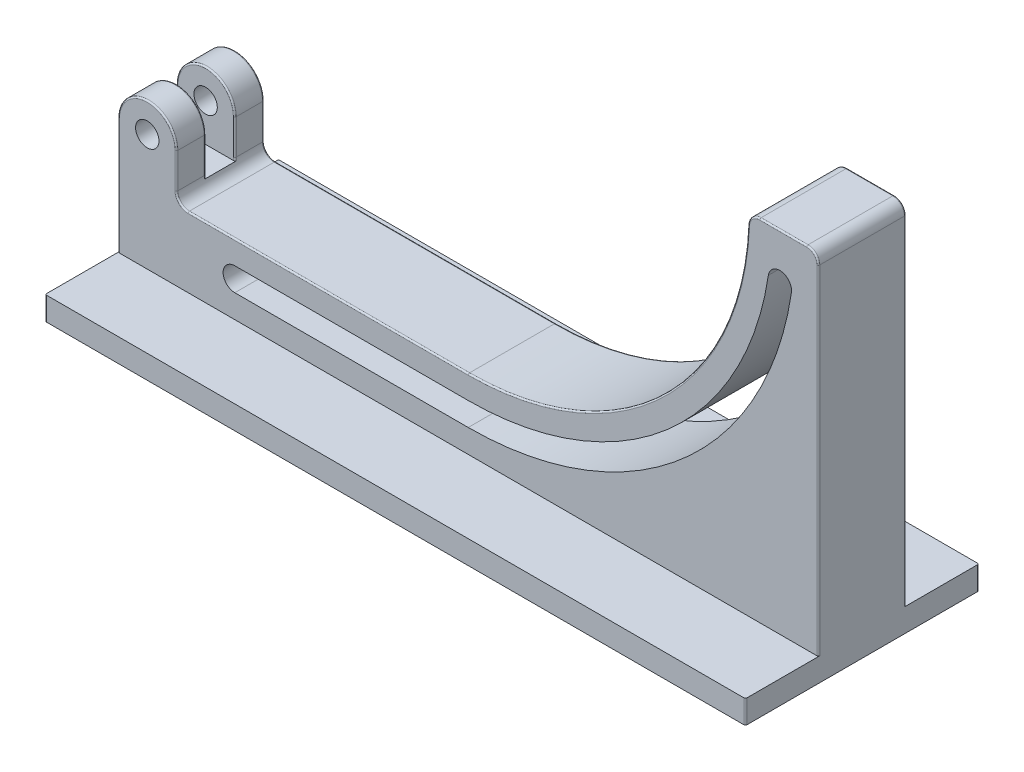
SolidWorks part; units mm, degrees
ref_plane "Front" through (0, 0, 0) normal (0, 0, 1) x (1, 0, 0)
ref_plane "Top" through (0, 0, 0) normal (0, 1, 0) x (1, 0, 0)
ref_plane "Right" through (0, 0, 0) normal (1, 0, 0) x (0, 0, -1)
sketch "Sketch1" plane through (0, 0, 0) normal (0, 1, 0) x (1, 0, 0)
  line L0 (-381, -127) -> (381, 127) construction
  line L1 (-381, 127) -> (381, 127)
  line L2 (-381, 127) -> (-381, -127)
  line L3 (-381, -127) -> (381, -127)
  line L4 (381, 127) -> (381, -127)
  dimension "D1" = 762
  dimension "D2" = 254
extrude "Extrude1" add sketch "Sketch1" against normal blind 25.4
sketch "Sketch2" plane through (0, 0, 0) normal (0, 0, 1) x (1, 0, 0)
  line L0 (-381, 0) -> (381, 0) construction
  line L1 (-381, 0) -> (-317.5, 0)
  line L2 (-381, 0) -> (-381, 127)
  line L4 (-317.5, 0) -> (-317.5, 127)
  arc A0 (-381, 127) -> (-317.5, 127) centre (-349.25, 127) cw
  circle A1 centre (-349.25, 127) radius 12.7
  dimension "D1" = 127
  dimension "D2" = 25.4
  dimension "D3" = 31.75
extrude "Extrude2" add sketch "Sketch2" along normal mid plane 95.25
sketch "Sketch3" plane through (-317.5, 0, 0) normal (1, 0, 0) x (0, 0, -1)
  line L0 (47.625, 158.75) -> (-47.625, 158.75) construction
  line L1 (-15.875, 85.725) -> (15.875, 85.725)
  line L2 (-15.875, 85.725) -> (-15.875, 158.75)
  line L3 (-15.875, 158.75) -> (15.875, 158.75)
  line L4 (15.875, 85.725) -> (15.875, 158.75)
  dimension "D1" = 31.75
  dimension "D2" = 15.875
  dimension "D3" = 73.025
extrude "Cut-Extrude1" cut sketch "Sketch3" against normal through all and the other way through all
sketch "Sketch4" plane through (0, 0, 0) normal (0, 0, 1) x (1, 0, 0)
  line L0 (381, 0) -> (381, 381)
  line L1 (381, 381) -> (304.8, 381)
  line L2 (381, 0) -> (-317.5, 0)
  line L3 (0, 50.8) -> (-254, 50.8)
  line L4 (0, 381) -> (304.8, 381) construction
  line L6 (0, 25.4) -> (-254, 25.4)
  line L8 (0, 76.2) -> (-317.5, 76.2)
  line L10 (-317.5, 76.2) -> (-317.5, 0)
  arc A0 (0, 76.2) -> (304.8, 381) centre (0, 381) ccw
  arc A1 (0, 50.8) -> (326.5563, 332.0815) centre (0, 381) ccw
  arc A2 (0, 25.4) -> (351.676, 328.3185) centre (0, 381) ccw
  arc A3 (326.5563, 332.0815) -> (351.676, 328.3185) centre (339.1162, 330.2) cw
  arc A4 (-254, 50.8) -> (-254, 25.4) centre (-254, 38.1) ccw
  dimension "D1" = 330.2
  dimension "D2" = 355.6
  dimension "D3" = 304.8
  dimension "D4" = 76.2
  dimension "D5" = 76.2
  dimension "D6" = 254
  dimension "D8" = 50.8
extrude "Extrude3" add sketch "Sketch4" along normal mid plane 95.25
fillet "Fillet1" radius 12.7 3 edges at (304.8, 381, 0) (381, 381, 0) (-317.5, 76.2, 0)
fillet "Fillet2" radius 1.5875 32 edges at (-317.5, 107.95, -47.625) (-381, 106.3625, -15.875) (-317.5, 107.95, -15.875) (-317.5, 107.95, 15.875) (-381, 106.3625, 15.875) (-317.5, 107.95, 47.625) (381, 184.15, -47.625) (381, 184.15, 47.625) (377.2803, 377.2803, 47.625) (377.2803, 377.2803, -47.625) (211.1716, 161.2056, 47.625) (211.1716, 161.2056, -47.625) (308.4471, 377.4581, 47.625) (308.4471, 377.4581, -47.625) (381, -12.7, -127) (-381, -12.7, -127) (381, -12.7, 127) (-381, -12.7, 127) (-349.25, 158.75, -47.625) (-349.25, 158.75, -15.875) (-349.25, 158.75, 15.875) (-349.25, 158.75, 47.625) (342.7729, 381, -47.625) (342.7729, 381, 47.625) (-152.4, 76.2, -47.625) (-152.4, 76.2, 47.625) (-317.3988, 87.2997, -15.875) (-317.3988, 87.2997, 15.875) (-313.7803, 79.9197, -47.625) (-313.7803, 79.9197, 47.625)
